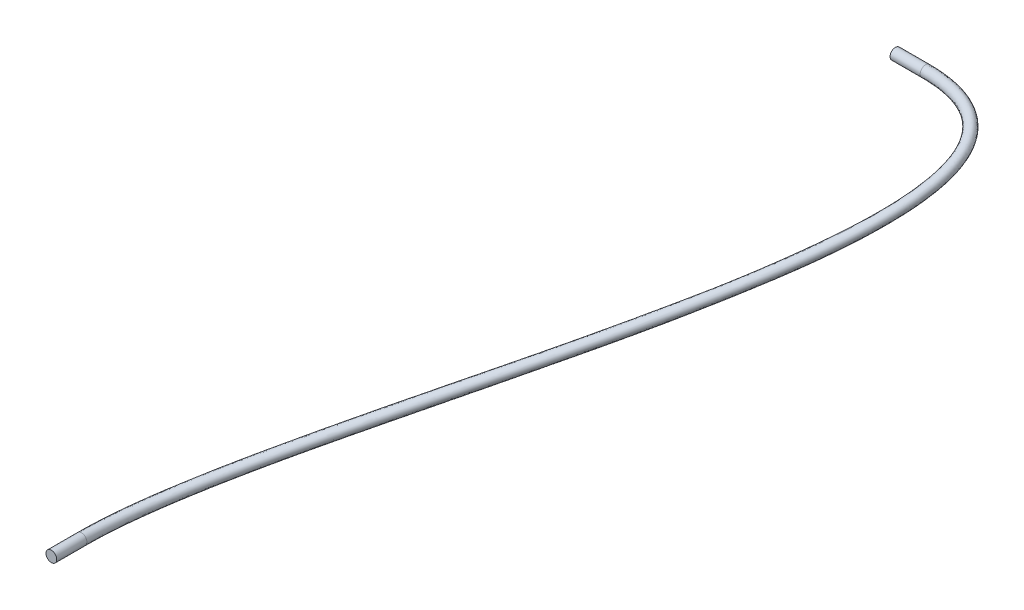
SolidWorks part; units mm, degrees
ref_plane "Front Plane" through (0, 0, 0) normal (0, 0, 1) x (1, 0, 0)
ref_plane "Top Plane" through (0, 0, 0) normal (0, 1, 0) x (1, 0, 0)
ref_plane "Right Plane" through (0, 0, 0) normal (1, 0, 0) x (0, 0, -1)
sketch3d "3DSketch1"
  line L0 (-193.8895, -138.225, 44.6645) -> (-193.8895, -138.225, 37.6645) construction
  line L1 (-130.012, -71.2232, -87.4315) -> (-123.012, -71.2232, -87.4315) construction
  line L2 (-193.8895, -138.225, 44.6645) -> (-193.8895, -138.225, 37.6645)
  line L3 (-130.012, -71.2232, -87.4315) -> (-123.012, -71.2232, -87.4315)
  spline S0 degree 3 poles (-1949.082, -692.7967, 438.5425) (2029.2035, 790.8548, -754.8209) (-2316.0564, -1097.9649, 544.3996) (1609.061, 708.207, -68.6304) knots -1.289508 -1.289508 -1.289508 -1.289508 2.460645 2.460645 2.460645 2.460645 only from (-123.012, -71.2232, -87.4315) to (-193.8895, -138.225, 37.6645) construction
  spline S1 degree 3 poles (-123.012, -71.2232, -87.4315) (-65.3866, -71.2232, -87.4315) (-193.8895, -138.225, -17.8934) (-193.8895, -138.225, 37.6645) knots 0 0 0 0 1 1 1 1
ref_plane "Plane1" through (-193.8895, -138.225, 44.6645) normal (0, 0, -1) x (-1, 0, 0)
sketch "PipeSketch" plane through (-193.8895, -138.225, 44.6645) normal (0, 0, -1) x (-1, 0, 0)
  circle A0 centre (0, 0) radius 1.25
  dimension "OuterDiameter" = 2.5
sweep "Cable_1" add profiles "PipeSketch" path "3DSketch1"
